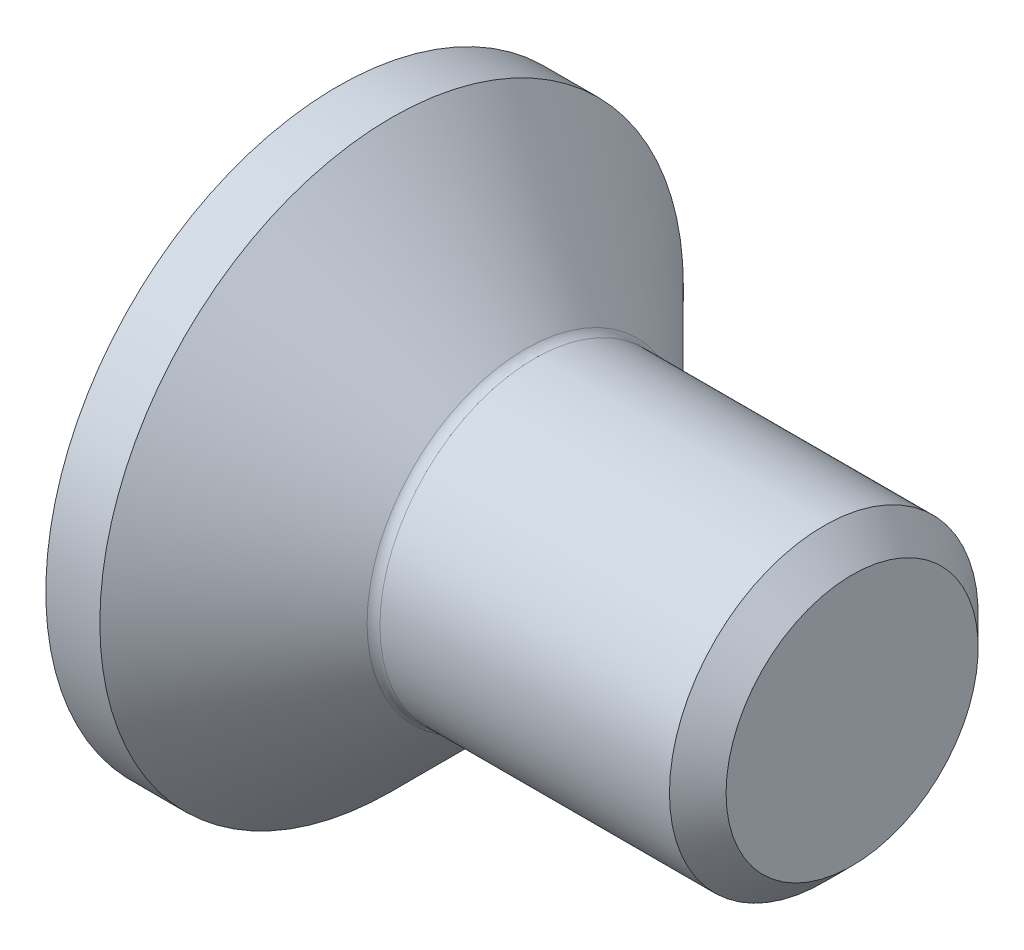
SolidWorks part; units mm, degrees
ref_plane "Front" through (0, 0, 0) normal (0, 0, 1) x (1, 0, 0)
ref_plane "Top" through (0, 0, 0) normal (0, 1, 0) x (1, 0, 0)
ref_plane "Right" through (0, 0, 0) normal (1, 0, 0) x (0, 0, -1)
sketch "Sketch1" plane through (0, 0, 0) normal (0, 0, 1) x (1, 0, 0)
  line L0 (0, 0) -> (0, 6.72)
  line L1 (0, 6.72) -> (3.72, 3)
  line L2 (3.72, 3) -> (10, 3)
  line L3 (10, 3) -> (10, 0)
  line L4 (10, 0) -> (0, 0)
  line L5 (-0.5871, 0) -> (5.4927, 0) construction
  dimension "D1" = 45
  dimension "l" = 10
  dimension "k" = 3.72
  dimension "d" = 6
revolve "Base" add sketch "Sketch1" angle 360 about L5
sketch "Sketch2" plane through (0, 0, 0) normal (1, 0, 0) x (0, 0, -1)
  line L1 (2.3094, 0) -> (1.1547, 2)
  line L2 (1.1547, 2) -> (-1.1547, 2)
  line L3 (-1.1547, 2) -> (-2.3094, 0)
  line L4 (-2.3094, 0) -> (-1.1547, -2)
  line L5 (-1.1547, -2) -> (1.1547, -2)
  line L6 (1.1547, -2) -> (2.3094, 0)
  circle A0 centre (0, 0) radius 2 construction
  dimension "s" = 4
extrude "HexagonSocket" cut sketch "Sketch2" along normal blind 1.1
sketch "Sketch3" plane through (0, 0, 0) normal (0, 0, 1) x (1, 0, 0)
  line L0 (-0.4391, 0) -> (4.425, 0) construction
  line L1 (1.1, 0) -> (1.1, -2) construction
  line L2 (1.1, 2) -> (2.2547, 0)
  line L3 (2.2547, 0) -> (1.1, -2) construction
  line L4 (1.1, 2) -> (1.1, 0)
  line L5 (1.1, 0) -> (2.2547, 0)
  line L7 (1.1, 2) -> (1.1, 0) construction
  dimension "D1" = 120
revolve "Cut-Revolve1" cut sketch "Sketch3" angle 360 about L0
fillet "HeadFillet" radius 0.25 1 edges at (3.72, 0, 3)
chamfer "Chamfer" distance 0.55 angle 45 1 edges at (10, 0, 3)
sketch "Sketch4" plane through (0, 0, 0) normal (0, 1, 0) x (1, 0, 0)
  line L0 (11.8531, 0) -> (-2.694, 0) construction
  line L1 (-2, 10.67) -> (3, 10.67)
  line L2 (-2, 10.67) -> (-2, 5.67)
  line L3 (-2, 5.67) -> (3, 5.67)
  line L4 (3, 10.67) -> (3, 5.67)
  line L5 (0, 6.72) -> (0, -6.72) construction
  dimension "dk" = 11.34
  dimension "D2" = 2
  dimension "D3" = 5
  dimension "D4" = 5
revolve "Cut-Revolve2" cut sketch "Sketch4" angle 360 about L0
sketch "Sketch5" plane through (0, 0, 0) normal (0, 0, 1) x (1, 0, 0)
  line L0 (9.45, 2.5237) -> (9.725, 3)
  line L1 (9.725, 3) -> (9.725, 3.55)
  line L2 (9.725, 3.55) -> (9.175, 3.55)
  line L3 (9.175, 3.55) -> (9.175, 3)
  line L4 (9.175, 3) -> (9.45, 2.5237)
  line L5 (0, 0) -> (10.6885, 0) construction
  line L6 (9.45, 3) -> (9.45, -3) construction
  dimension "D1" = 6
  dimension "D2" = 0.55
revolve "Cut-Revolve10" [suppressed] cut sketch "Sketch5" angle 360 about L5
pattern_linear "LPattern10" [suppressed] count 7 spacing 0.66 along (1, 0, 0)
equation "\"D1@Chamfer\" = (  \"d@Sketch1\" - \"D2@ThreadCosmetic1\" )  / 2"
equation "\"D1@Sketch5\" = \"d@Sketch1\""
equation "\"D2@Sketch5\" =  ( \"d@Sketch1\" - \"D2@ThreadCosmetic1\" )  / 2"
equation "\"D3@LPattern10\" = \"D2@Sketch5\" * 1.2"
equation "\"D1@LPattern10\" = \"b@ThreadCosmetic1\" / \"D3@LPattern10\""
